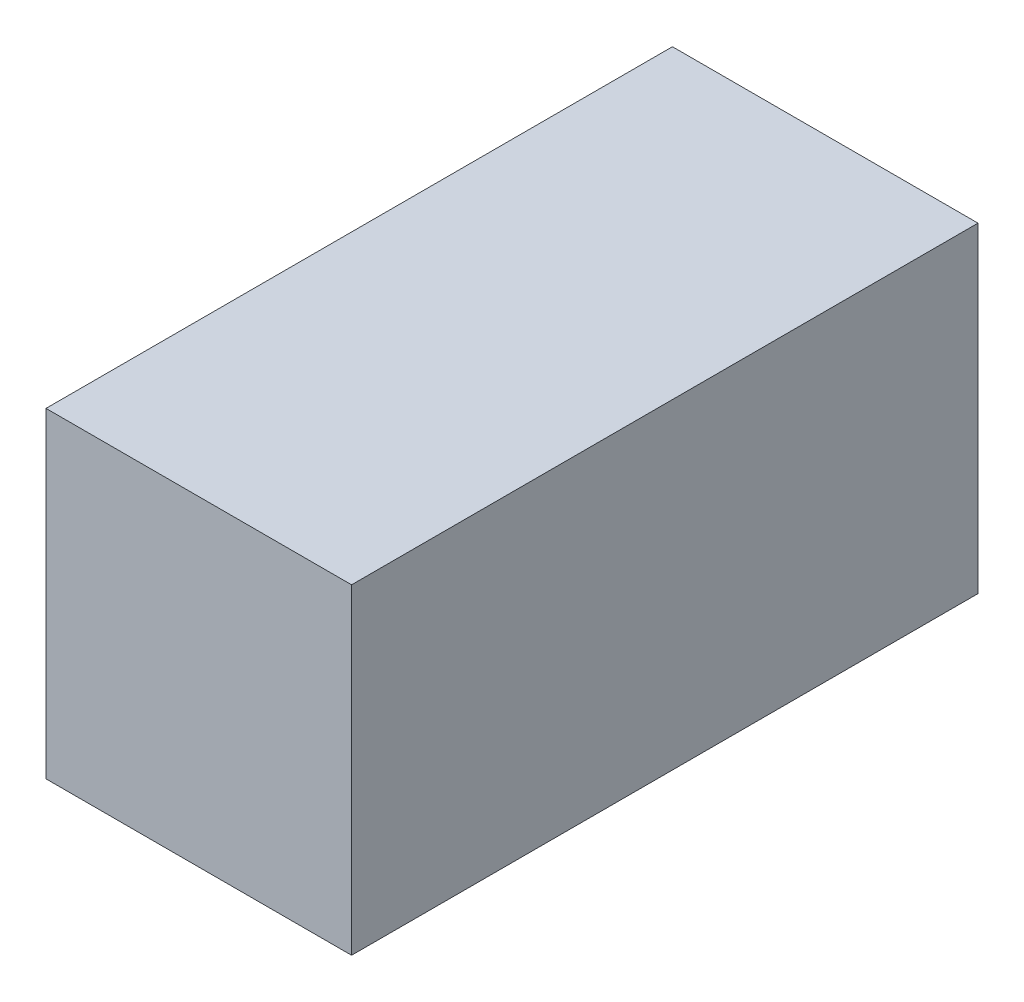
SolidWorks part; units mm, degrees
ref_plane "前视基准面" through (0, 0, 0) normal (0, 0, 1) x (1, 0, 0)
ref_plane "上视基准面" through (0, 0, 0) normal (0, 1, 0) x (1, 0, 0)
ref_plane "右视基准面" through (0, 0, 0) normal (1, 0, 0) x (0, 0, -1)
sketch "Sketch1" plane through (0, 0, 0) normal (0, 1, 0) x (1, 0, 0)
  line L1 (-1, -2.05) -> (1, -2.05)
  line L2 (-1, -2.05) -> (-1, 2.05)
  line L3 (-1, 2.05) -> (1, 2.05)
  line L4 (1, -2.05) -> (1, 2.05)
  line L5 (-1, -2.05) -> (1, 2.05) construction
  line L6 (-1, 2.05) -> (1, -2.05) construction
  point P0 (0, 0)
  dimension "D1" = 2
  dimension "D2" = 4.1
extrude "Boss-Extrude1" add sketch "Sketch1" along normal blind 2.1
